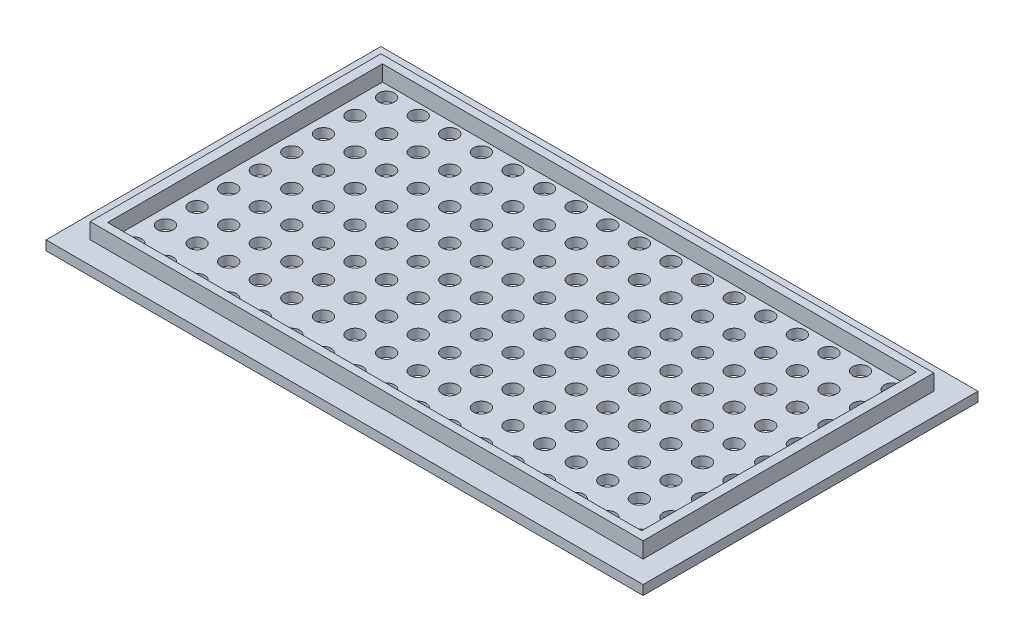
SolidWorks part; units mm, degrees
ref_plane "Piano frontale" through (0, 0, 0) normal (0, 0, 1) x (1, 0, 0)
ref_plane "Piano superiore" through (0, 0, 0) normal (0, 1, 0) x (1, 0, 0)
ref_plane "Piano destro" through (0, 0, 0) normal (1, 0, 0) x (0, 0, -1)
sketch "Schizzo1" plane through (0, 0, 0) normal (0, 1, 0) x (1, 0, 0)
  line L1 (-213.9362, 61.3674) -> (-24.9362, 61.3674)
  line L2 (-213.9362, 61.3674) -> (-213.9362, -44.6326)
  line L3 (-213.9362, -44.6326) -> (-24.9362, -44.6326)
  line L4 (-24.9362, 61.3674) -> (-24.9362, -44.6326)
  point P4 (-129.0374, 20.1117)
  point P5 (-129.0374, 8.2817)
  circle B0 centre (-199.0374, 48.2817) radius 2.5
  circle B1 centre (-189.0374, 48.2817) radius 2.5
  circle B2 centre (-179.0374, 48.2817) radius 2.5
  circle B3 centre (-169.0374, 48.2817) radius 2.5
  circle B4 centre (-159.0374, 48.2817) radius 2.5
  circle B5 centre (-149.0374, 48.2817) radius 2.5
  circle B6 centre (-139.0374, 48.2817) radius 2.5
  circle B7 centre (-129.0374, 48.2817) radius 2.5
  circle B8 centre (-119.0374, 48.2817) radius 2.5
  circle B9 centre (-109.0374, 48.2817) radius 2.5
  circle B10 centre (-99.0374, 48.2817) radius 2.5
  circle B11 centre (-89.0374, 48.2817) radius 2.5
  circle B12 centre (-79.0374, 48.2817) radius 2.5
  circle B13 centre (-69.0374, 48.2817) radius 2.5
  circle B14 centre (-59.0374, 48.2817) radius 2.5
  circle B15 centre (-49.0374, 48.2817) radius 2.5
  circle B16 centre (-39.0374, 48.2817) radius 2.5
  circle B17 centre (-189.0374, 48.2817) radius 2.5
  circle B18 centre (-179.0374, 48.2817) radius 2.5
  circle B19 centre (-169.0374, 48.2817) radius 2.5
  circle B20 centre (-159.0374, 48.2817) radius 2.5
  circle B21 centre (-149.0374, 48.2817) radius 2.5
  circle B22 centre (-139.0374, 48.2817) radius 2.5
  circle B23 centre (-129.0374, 48.2817) radius 2.5
  circle B24 centre (-119.0374, 48.2817) radius 2.5
  circle B25 centre (-109.0374, 48.2817) radius 2.5
  circle B26 centre (-99.0374, 48.2817) radius 2.5
  circle B27 centre (-89.0374, 48.2817) radius 2.5
  circle B28 centre (-79.0374, 48.2817) radius 2.5
  circle B29 centre (-69.0374, 48.2817) radius 2.5
  circle B30 centre (-59.0374, 48.2817) radius 2.5
  circle B31 centre (-49.0374, 48.2817) radius 2.5
  circle B32 centre (-39.0374, 48.2817) radius 2.5
  circle B33 centre (-189.0374, 38.2817) radius 2.5
  circle B34 centre (-179.0374, 38.2817) radius 2.5
  circle B35 centre (-169.0374, 38.2817) radius 2.5
  circle B36 centre (-159.0374, 38.2817) radius 2.5
  circle B37 centre (-149.0374, 38.2817) radius 2.5
  circle B38 centre (-139.0374, 38.2817) radius 2.5
  circle B39 centre (-129.0374, 38.2817) radius 2.5
  circle B40 centre (-119.0374, 38.2817) radius 2.5
  circle B41 centre (-109.0374, 38.2817) radius 2.5
  circle B42 centre (-99.0374, 38.2817) radius 2.5
  circle B43 centre (-89.0374, 38.2817) radius 2.5
  circle B44 centre (-79.0374, 38.2817) radius 2.5
  circle B45 centre (-69.0374, 38.2817) radius 2.5
  circle B46 centre (-59.0374, 38.2817) radius 2.5
  circle B47 centre (-49.0374, 38.2817) radius 2.5
  circle B48 centre (-39.0374, 38.2817) radius 2.5
  circle B49 centre (-189.0374, 28.2817) radius 2.5
  circle B50 centre (-179.0374, 28.2817) radius 2.5
  circle B51 centre (-169.0374, 28.2817) radius 2.5
  circle B52 centre (-159.0374, 28.2817) radius 2.5
  circle B53 centre (-149.0374, 28.2817) radius 2.5
  circle B54 centre (-139.0374, 28.2817) radius 2.5
  circle B55 centre (-129.0374, 28.2817) radius 2.5
  circle B56 centre (-119.0374, 28.2817) radius 2.5
  circle B57 centre (-109.0374, 28.2817) radius 2.5
  circle B58 centre (-99.0374, 28.2817) radius 2.5
  circle B59 centre (-89.0374, 28.2817) radius 2.5
  circle B60 centre (-79.0374, 28.2817) radius 2.5
  circle B61 centre (-69.0374, 28.2817) radius 2.5
  circle B62 centre (-59.0374, 28.2817) radius 2.5
  circle B63 centre (-49.0374, 28.2817) radius 2.5
  circle B64 centre (-39.0374, 28.2817) radius 2.5
  circle B65 centre (-189.0374, 18.2817) radius 2.5
  circle B66 centre (-179.0374, 18.2817) radius 2.5
  circle B67 centre (-169.0374, 18.2817) radius 2.5
  circle B68 centre (-159.0374, 18.2817) radius 2.5
  circle B69 centre (-149.0374, 18.2817) radius 2.5
  circle B70 centre (-139.0374, 18.2817) radius 2.5
  circle B71 centre (-129.0374, 18.2817) radius 2.5
  circle B72 centre (-119.0374, 18.2817) radius 2.5
  circle B73 centre (-109.0374, 18.2817) radius 2.5
  circle B74 centre (-99.0374, 18.2817) radius 2.5
  circle B75 centre (-89.0374, 18.2817) radius 2.5
  circle B76 centre (-79.0374, 18.2817) radius 2.5
  circle B77 centre (-69.0374, 18.2817) radius 2.5
  circle B78 centre (-59.0374, 18.2817) radius 2.5
  circle B79 centre (-49.0374, 18.2817) radius 2.5
  circle B80 centre (-39.0374, 18.2817) radius 2.5
  circle B81 centre (-189.0374, 8.2817) radius 2.5
  circle B82 centre (-179.0374, 8.2817) radius 2.5
  circle B83 centre (-169.0374, 8.2817) radius 2.5
  circle B84 centre (-159.0374, 8.2817) radius 2.5
  circle B85 centre (-149.0374, 8.2817) radius 2.5
  circle B86 centre (-139.0374, 8.2817) radius 2.5
  circle B87 centre (-129.0374, 8.2817) radius 2.5
  circle B88 centre (-119.0374, 8.2817) radius 2.5
  circle B89 centre (-109.0374, 8.2817) radius 2.5
  circle B90 centre (-99.0374, 8.2817) radius 2.5
  circle B91 centre (-89.0374, 8.2817) radius 2.5
  circle B92 centre (-79.0374, 8.2817) radius 2.5
  circle B93 centre (-69.0374, 8.2817) radius 2.5
  circle B94 centre (-59.0374, 8.2817) radius 2.5
  circle B95 centre (-49.0374, 8.2817) radius 2.5
  circle B96 centre (-39.0374, 8.2817) radius 2.5
  circle B97 centre (-189.0374, -1.7183) radius 2.5
  circle B98 centre (-179.0374, -1.7183) radius 2.5
  circle B99 centre (-169.0374, -1.7183) radius 2.5
  circle B100 centre (-159.0374, -1.7183) radius 2.5
  circle B101 centre (-149.0374, -1.7183) radius 2.5
  circle B102 centre (-139.0374, -1.7183) radius 2.5
  circle B103 centre (-129.0374, -1.7183) radius 2.5
  circle B104 centre (-119.0374, -1.7183) radius 2.5
  circle B105 centre (-109.0374, -1.7183) radius 2.5
  circle B106 centre (-99.0374, -1.7183) radius 2.5
  circle B107 centre (-89.0374, -1.7183) radius 2.5
  circle B108 centre (-79.0374, -1.7183) radius 2.5
  circle B109 centre (-69.0374, -1.7183) radius 2.5
  circle B110 centre (-59.0374, -1.7183) radius 2.5
  circle B111 centre (-49.0374, -1.7183) radius 2.5
  circle B112 centre (-39.0374, -1.7183) radius 2.5
  circle B113 centre (-189.0374, -11.7183) radius 2.5
  circle B114 centre (-179.0374, -11.7183) radius 2.5
  circle B115 centre (-169.0374, -11.7183) radius 2.5
  circle B116 centre (-159.0374, -11.7183) radius 2.5
  circle B117 centre (-149.0374, -11.7183) radius 2.5
  circle B118 centre (-139.0374, -11.7183) radius 2.5
  circle B119 centre (-129.0374, -11.7183) radius 2.5
  circle B120 centre (-119.0374, -11.7183) radius 2.5
  circle B121 centre (-109.0374, -11.7183) radius 2.5
  circle B122 centre (-99.0374, -11.7183) radius 2.5
  circle B123 centre (-89.0374, -11.7183) radius 2.5
  circle B124 centre (-79.0374, -11.7183) radius 2.5
  circle B125 centre (-69.0374, -11.7183) radius 2.5
  circle B126 centre (-59.0374, -11.7183) radius 2.5
  circle B127 centre (-49.0374, -11.7183) radius 2.5
  circle B128 centre (-39.0374, -11.7183) radius 2.5
  circle B129 centre (-189.0374, -21.7183) radius 2.5
  circle B130 centre (-179.0374, -21.7183) radius 2.5
  circle B131 centre (-169.0374, -21.7183) radius 2.5
  circle B132 centre (-159.0374, -21.7183) radius 2.5
  circle B133 centre (-149.0374, -21.7183) radius 2.5
  circle B134 centre (-139.0374, -21.7183) radius 2.5
  circle B135 centre (-129.0374, -21.7183) radius 2.5
  circle B136 centre (-119.0374, -21.7183) radius 2.5
  circle B137 centre (-109.0374, -21.7183) radius 2.5
  circle B138 centre (-99.0374, -21.7183) radius 2.5
  circle B139 centre (-89.0374, -21.7183) radius 2.5
  circle B140 centre (-79.0374, -21.7183) radius 2.5
  circle B141 centre (-69.0374, -21.7183) radius 2.5
  circle B142 centre (-59.0374, -21.7183) radius 2.5
  circle B143 centre (-49.0374, -21.7183) radius 2.5
  circle B144 centre (-39.0374, -21.7183) radius 2.5
  circle B145 centre (-189.0374, -31.7183) radius 2.5
  circle B146 centre (-179.0374, -31.7183) radius 2.5
  circle B147 centre (-169.0374, -31.7183) radius 2.5
  circle B148 centre (-159.0374, -31.7183) radius 2.5
  circle B149 centre (-149.0374, -31.7183) radius 2.5
  circle B150 centre (-139.0374, -31.7183) radius 2.5
  circle B151 centre (-129.0374, -31.7183) radius 2.5
  circle B152 centre (-119.0374, -31.7183) radius 2.5
  circle B153 centre (-109.0374, -31.7183) radius 2.5
  circle B154 centre (-99.0374, -31.7183) radius 2.5
  circle B155 centre (-89.0374, -31.7183) radius 2.5
  circle B156 centre (-79.0374, -31.7183) radius 2.5
  circle B157 centre (-69.0374, -31.7183) radius 2.5
  circle B158 centre (-59.0374, -31.7183) radius 2.5
  circle B159 centre (-49.0374, -31.7183) radius 2.5
  circle B160 centre (-39.0374, -31.7183) radius 2.5
  circle B161 centre (-199.0374, 38.2817) radius 2.5
  circle B162 centre (-189.0374, 38.2817) radius 2.5
  circle B163 centre (-179.0374, 38.2817) radius 2.5
  circle B164 centre (-169.0374, 38.2817) radius 2.5
  circle B165 centre (-159.0374, 38.2817) radius 2.5
  circle B166 centre (-149.0374, 38.2817) radius 2.5
  circle B167 centre (-139.0374, 38.2817) radius 2.5
  circle B168 centre (-129.0374, 38.2817) radius 2.5
  circle B169 centre (-119.0374, 38.2817) radius 2.5
  circle B170 centre (-109.0374, 38.2817) radius 2.5
  circle B171 centre (-99.0374, 38.2817) radius 2.5
  circle B172 centre (-89.0374, 38.2817) radius 2.5
  circle B173 centre (-79.0374, 38.2817) radius 2.5
  circle B174 centre (-69.0374, 38.2817) radius 2.5
  circle B175 centre (-59.0374, 38.2817) radius 2.5
  circle B176 centre (-49.0374, 38.2817) radius 2.5
  circle B177 centre (-199.0374, 28.2817) radius 2.5
  circle B178 centre (-189.0374, 28.2817) radius 2.5
  circle B179 centre (-179.0374, 28.2817) radius 2.5
  circle B180 centre (-169.0374, 28.2817) radius 2.5
  circle B181 centre (-159.0374, 28.2817) radius 2.5
  circle B182 centre (-149.0374, 28.2817) radius 2.5
  circle B183 centre (-139.0374, 28.2817) radius 2.5
  circle B184 centre (-129.0374, 28.2817) radius 2.5
  circle B185 centre (-119.0374, 28.2817) radius 2.5
  circle B186 centre (-109.0374, 28.2817) radius 2.5
  circle B187 centre (-99.0374, 28.2817) radius 2.5
  circle B188 centre (-89.0374, 28.2817) radius 2.5
  circle B189 centre (-79.0374, 28.2817) radius 2.5
  circle B190 centre (-69.0374, 28.2817) radius 2.5
  circle B191 centre (-59.0374, 28.2817) radius 2.5
  circle B192 centre (-49.0374, 28.2817) radius 2.5
  circle B193 centre (-199.0374, 18.2817) radius 2.5
  circle B194 centre (-189.0374, 18.2817) radius 2.5
  circle B195 centre (-179.0374, 18.2817) radius 2.5
  circle B196 centre (-169.0374, 18.2817) radius 2.5
  circle B197 centre (-159.0374, 18.2817) radius 2.5
  circle B198 centre (-149.0374, 18.2817) radius 2.5
  circle B199 centre (-139.0374, 18.2817) radius 2.5
  circle B200 centre (-129.0374, 18.2817) radius 2.5
  circle B201 centre (-119.0374, 18.2817) radius 2.5
  circle B202 centre (-109.0374, 18.2817) radius 2.5
  circle B203 centre (-99.0374, 18.2817) radius 2.5
  circle B204 centre (-89.0374, 18.2817) radius 2.5
  circle B205 centre (-79.0374, 18.2817) radius 2.5
  circle B206 centre (-69.0374, 18.2817) radius 2.5
  circle B207 centre (-59.0374, 18.2817) radius 2.5
  circle B208 centre (-49.0374, 18.2817) radius 2.5
  circle B209 centre (-199.0374, 8.2817) radius 2.5
  circle B210 centre (-189.0374, 8.2817) radius 2.5
  circle B211 centre (-179.0374, 8.2817) radius 2.5
  circle B212 centre (-169.0374, 8.2817) radius 2.5
  circle B213 centre (-159.0374, 8.2817) radius 2.5
  circle B214 centre (-149.0374, 8.2817) radius 2.5
  circle B215 centre (-139.0374, 8.2817) radius 2.5
  circle B216 centre (-129.0374, 8.2817) radius 2.5
  circle B217 centre (-119.0374, 8.2817) radius 2.5
  circle B218 centre (-109.0374, 8.2817) radius 2.5
  circle B219 centre (-99.0374, 8.2817) radius 2.5
  circle B220 centre (-89.0374, 8.2817) radius 2.5
  circle B221 centre (-79.0374, 8.2817) radius 2.5
  circle B222 centre (-69.0374, 8.2817) radius 2.5
  circle B223 centre (-59.0374, 8.2817) radius 2.5
  circle B224 centre (-49.0374, 8.2817) radius 2.5
  circle B225 centre (-199.0374, -1.7183) radius 2.5
  circle B226 centre (-189.0374, -1.7183) radius 2.5
  circle B227 centre (-179.0374, -1.7183) radius 2.5
  circle B228 centre (-169.0374, -1.7183) radius 2.5
  circle B229 centre (-159.0374, -1.7183) radius 2.5
  circle B230 centre (-149.0374, -1.7183) radius 2.5
  circle B231 centre (-139.0374, -1.7183) radius 2.5
  circle B232 centre (-129.0374, -1.7183) radius 2.5
  circle B233 centre (-119.0374, -1.7183) radius 2.5
  circle B234 centre (-109.0374, -1.7183) radius 2.5
  circle B235 centre (-99.0374, -1.7183) radius 2.5
  circle B236 centre (-89.0374, -1.7183) radius 2.5
  circle B237 centre (-79.0374, -1.7183) radius 2.5
  circle B238 centre (-69.0374, -1.7183) radius 2.5
  circle B239 centre (-59.0374, -1.7183) radius 2.5
  circle B240 centre (-49.0374, -1.7183) radius 2.5
  circle B241 centre (-199.0374, -11.7183) radius 2.5
  circle B242 centre (-189.0374, -11.7183) radius 2.5
  circle B243 centre (-179.0374, -11.7183) radius 2.5
  circle B244 centre (-169.0374, -11.7183) radius 2.5
  circle B245 centre (-159.0374, -11.7183) radius 2.5
  circle B246 centre (-149.0374, -11.7183) radius 2.5
  circle B247 centre (-139.0374, -11.7183) radius 2.5
  circle B248 centre (-129.0374, -11.7183) radius 2.5
  circle B249 centre (-119.0374, -11.7183) radius 2.5
  circle B250 centre (-109.0374, -11.7183) radius 2.5
  circle B251 centre (-99.0374, -11.7183) radius 2.5
  circle B252 centre (-89.0374, -11.7183) radius 2.5
  circle B253 centre (-79.0374, -11.7183) radius 2.5
  circle B254 centre (-69.0374, -11.7183) radius 2.5
  circle B255 centre (-59.0374, -11.7183) radius 2.5
  circle B256 centre (-49.0374, -11.7183) radius 2.5
  circle B257 centre (-199.0374, -21.7183) radius 2.5
  circle B258 centre (-189.0374, -21.7183) radius 2.5
  circle B259 centre (-179.0374, -21.7183) radius 2.5
  circle B260 centre (-169.0374, -21.7183) radius 2.5
  circle B261 centre (-159.0374, -21.7183) radius 2.5
  circle B262 centre (-149.0374, -21.7183) radius 2.5
  circle B263 centre (-139.0374, -21.7183) radius 2.5
  circle B264 centre (-129.0374, -21.7183) radius 2.5
  circle B265 centre (-119.0374, -21.7183) radius 2.5
  circle B266 centre (-109.0374, -21.7183) radius 2.5
  circle B267 centre (-99.0374, -21.7183) radius 2.5
  circle B268 centre (-89.0374, -21.7183) radius 2.5
  circle B269 centre (-79.0374, -21.7183) radius 2.5
  circle B270 centre (-69.0374, -21.7183) radius 2.5
  circle B271 centre (-59.0374, -21.7183) radius 2.5
  circle B272 centre (-49.0374, -21.7183) radius 2.5
  circle B273 centre (-199.0374, -31.7183) radius 2.5
  circle B274 centre (-189.0374, -31.7183) radius 2.5
  circle B275 centre (-179.0374, -31.7183) radius 2.5
  circle B276 centre (-169.0374, -31.7183) radius 2.5
  circle B277 centre (-159.0374, -31.7183) radius 2.5
  circle B278 centre (-149.0374, -31.7183) radius 2.5
  circle B279 centre (-139.0374, -31.7183) radius 2.5
  circle B280 centre (-129.0374, -31.7183) radius 2.5
  circle B281 centre (-119.0374, -31.7183) radius 2.5
  circle B282 centre (-109.0374, -31.7183) radius 2.5
  circle B283 centre (-99.0374, -31.7183) radius 2.5
  circle B284 centre (-89.0374, -31.7183) radius 2.5
  circle B285 centre (-79.0374, -31.7183) radius 2.5
  circle B286 centre (-69.0374, -31.7183) radius 2.5
  circle B287 centre (-59.0374, -31.7183) radius 2.5
  circle B288 centre (-49.0374, -31.7183) radius 2.5
  dimension "D1" = 189
  dimension "D2" = 106
sketch_block_instance "Blocco1-1"
sketch_block "Blocco1"
extrude "Estrusione-Estrusione1" add sketch "Schizzo1" along normal blind 3
sketch "Schizzo2" plane through (0, 3, 0) normal (0, 1, 0) x (1, 0, 0)
  line L0 (-206.9362, 54.3674) -> (-31.9362, 54.3674)
  line L1 (-206.9362, 54.3674) -> (-206.9362, -37.6326)
  line L2 (-206.9362, -37.6326) -> (-31.9362, -37.6326)
  line L3 (-31.9362, 54.3674) -> (-31.9362, -37.6326)
  line L4 (-213.9362, 61.3674) -> (-24.9362, 61.3674) construction
  line L5 (-213.9362, 61.3674) -> (-213.9362, -44.6326) construction
  line L9 (-203.9362, -35.1326) -> (-34.9362, -35.1326)
  line L10 (-203.9362, -35.1326) -> (-203.9362, 51.8674)
  line L11 (-203.9362, 51.8674) -> (-34.9362, 51.8674)
  line L12 (-34.9362, -35.1326) -> (-34.9362, 51.8674)
  dimension "D1" = 175
  dimension "D2" = 92
  dimension "D3" = 7
  dimension "D4" = 7
  dimension "D5" = 3
  dimension "D6" = 3
  dimension "D7" = 2.5
  dimension "D8" = 2.5
extrude "Estrusione-Estrusione2" add sketch "Schizzo2" along normal blind 5
